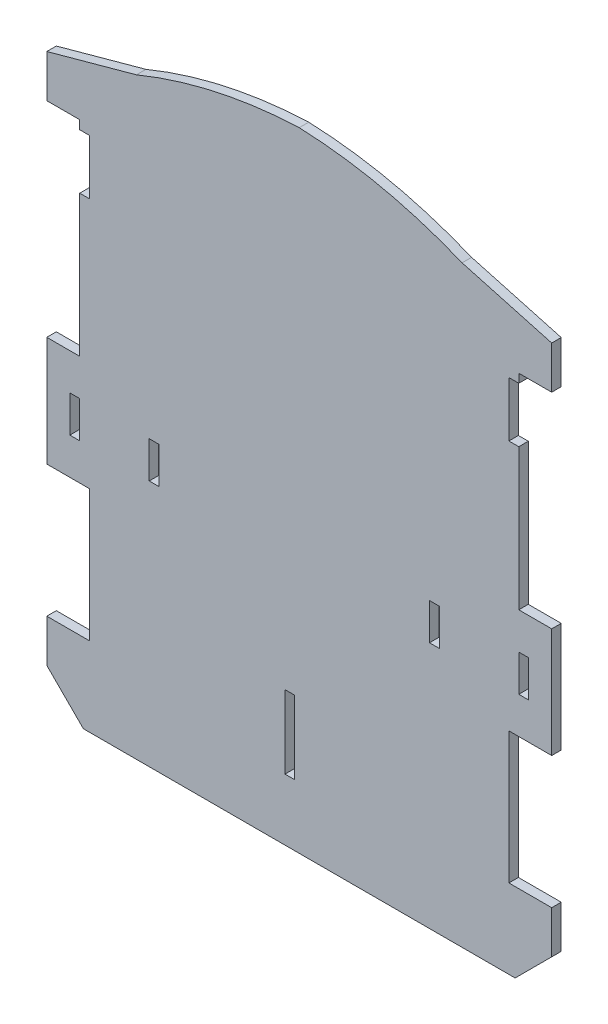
SolidWorks part; units mm, degrees
ref_plane "Alzado" through (0, 0, 0) normal (0, 0, 1) x (1, 0, 0)
ref_plane "Planta" through (0, 0, 0) normal (0, 1, 0) x (1, 0, 0)
ref_plane "Vista lateral" through (0, 0, 0) normal (1, 0, 0) x (0, 0, -1)
sketch "Croquis1" plane through (0, 0, 0) normal (0, 0, 1) x (1, 0, 0)
  line L9 (66.1863, -36.8821) -> (77.8863, -36.8821)
  line L10 (68.8863, 49.1179) -> (77.8863, 49.1179)
  line L24 (68.8863, -6.8821) -> (77.8863, -6.8821)
  line L26 (77.8863, 60.7629) -> (77.8863, 49.1179)
  line L30 (68.8863, 49.1179) -> (68.8863, 46.7344)
  line L31 (77.8863, -36.8821) -> (77.8863, -6.8821)
  line L33 (77.8863, -84.527) -> (77.8863, -72.8821)
  line L40 (77.8863, 60.7629) -> (53.3863, 67.4939)
  line L43 (67.8863, -94.527) -> (77.8863, -84.527)
  line L45 (71.5863, -16.8821) -> (68.8863, -16.8821)
  line L52 (47.1863, -16.8821) -> (44.4863, -16.8821)
  line L53 (44.4863, -26.8821) -> (44.4863, -16.8821)
  line L54 (47.1863, -26.8821) -> (44.4863, -26.8821)
  line L55 (47.1863, -26.8821) -> (47.1863, -16.8821)
  line L58 (71.5863, -26.8821) -> (68.8863, -26.8821)
  line L59 (68.8863, -26.8821) -> (68.8863, -16.8821)
  line L60 (71.5863, -26.8821) -> (71.5863, -16.8821)
  line L61 (68.8863, 46.7344) -> (66.1863, 46.7344)
  line L62 (66.1863, 46.7344) -> (66.1863, 31.7279)
  line L63 (66.1863, 31.7279) -> (68.8863, 31.7279)
  line L64 (68.8863, 31.7279) -> (68.8863, -6.8821)
  line L69 (66.1863, -91.55) -> (66.1863, -72.8821) construction
  line L80 (66.1863, -72.8821) -> (66.1863, -36.8821)
  line L81 (77.8863, -72.8821) -> (66.1863, -72.8821)
  line L82 (7.5863, -77.7154) -> (4.9863, -77.7154)
  line L83 (-60.1137, -72.8821) -> (-48.4137, -72.8821)
  line L84 (-48.4137, -72.8821) -> (-48.4137, -36.8821)
  line L85 (-51.1137, 31.7279) -> (-51.1137, -6.8821)
  line L86 (-48.4137, 31.7279) -> (-51.1137, 31.7279)
  line L87 (-48.4137, 46.7344) -> (-48.4137, 31.7279)
  line L88 (-51.1137, 46.7344) -> (-48.4137, 46.7344)
  line L89 (7.5863, -77.7154) -> (7.5863, -57.7154)
  line L90 (7.5863, -57.7154) -> (4.9863, -57.7154)
  line L91 (-53.8137, -26.8821) -> (-53.8137, -16.8821)
  line L92 (-51.1137, -26.8821) -> (-51.1137, -16.8821)
  line L93 (-53.8137, -26.8821) -> (-51.1137, -26.8821)
  line L94 (-32.1137, -26.8821) -> (-32.1137, -16.8821)
  line L95 (-32.1137, -26.8821) -> (-29.4137, -26.8821)
  line L96 (-29.4137, -26.8821) -> (-29.4137, -16.8821)
  line L97 (-32.1137, -16.8821) -> (-29.4137, -16.8821)
  line L98 (-53.8137, -16.8821) -> (-51.1137, -16.8821)
  line L99 (-50.1137, -94.527) -> (-60.1137, -84.527)
  line L100 (-60.1137, 60.7629) -> (-35.6137, 67.4939)
  line L101 (-60.1137, -84.527) -> (-60.1137, -72.8821)
  line L102 (-60.1137, -36.8821) -> (-60.1137, -6.8821)
  line L103 (-51.1137, 49.1179) -> (-51.1137, 46.7344)
  line L104 (-60.1137, 60.7629) -> (-60.1137, 49.1179)
  line L105 (-51.1137, -6.8821) -> (-60.1137, -6.8821)
  line L106 (-51.1137, 49.1179) -> (-60.1137, 49.1179)
  line L107 (-48.4137, -36.8821) -> (-60.1137, -36.8821)
  line L108 (-50.1137, -94.527) -> (67.8863, -94.527)
  line L109 (4.9863, -77.7154) -> (4.9863, -57.7154)
  arc A1 (53.3863, 67.4939) -> (8.8863, 77.2304) centre (3.8857, -52.1851) ccw
  arc A4 (-35.6137, 67.4939) -> (8.8863, 77.2304) centre (13.8869, -52.1851) cw
  point P1 (48.8863, -49.9526)
  point P12 (48.8863, 54.1179)
  point P24 (57.8863, -94.527)
  point P52 (77.8863, -94.527)
  point P54 (-60.1137, -94.527)
  point P59 (-40.1137, -94.527)
extrude "Saliente-Extruir1" add sketch "Croquis1" along normal blind 2.6
